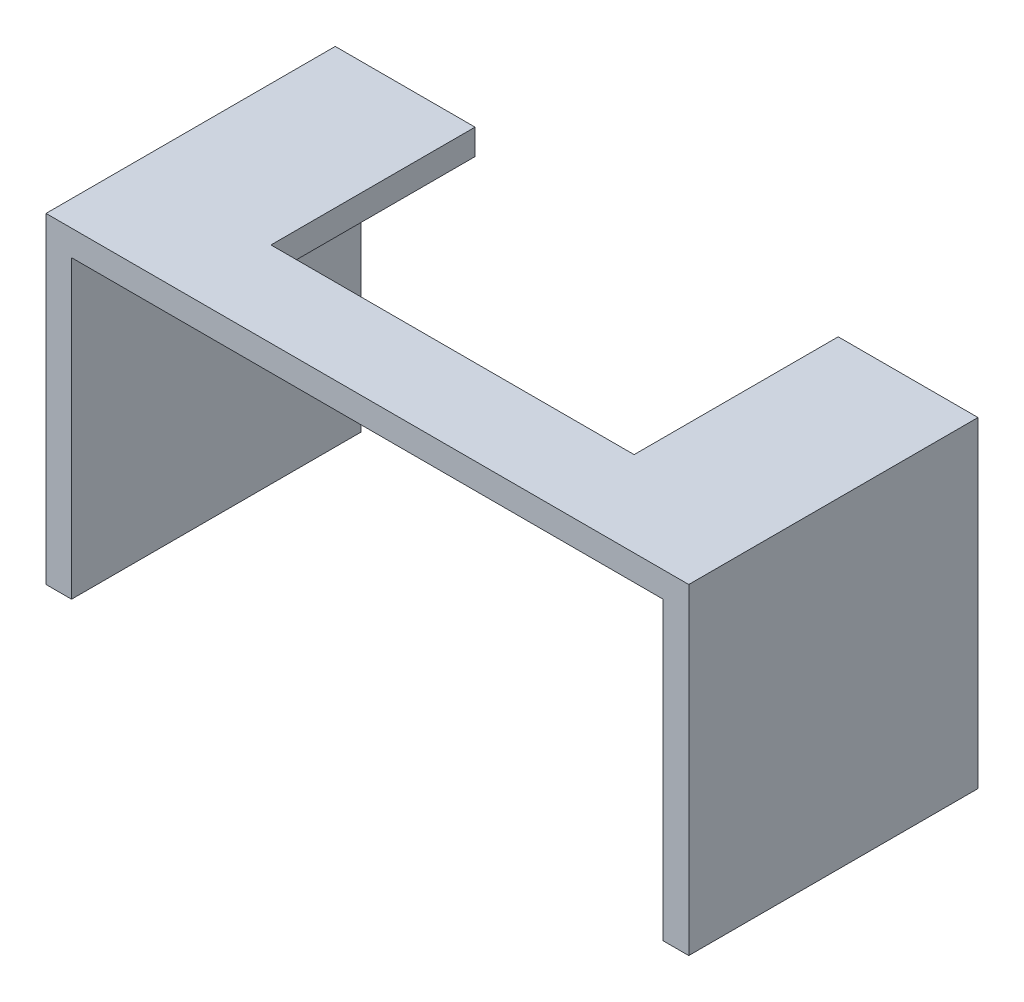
SolidWorks part; units mm, degrees
ref_plane "Front Plane" through (0, 0, 0) normal (0, 0, 1) x (1, 0, 0)
ref_plane "Top Plane" through (0, 0, 0) normal (0, 1, 0) x (1, 0, 0)
ref_plane "Right Plane" through (0, 0, 0) normal (1, 0, 0) x (0, 0, -1)
sketch "Sketch1" plane through (0, 0, 0) normal (0, 0, 1) x (1, 0, 0)
  line L0 (1.59, -20) -> (1.59, -1.59)
  line L1 (0, -20) -> (0, 0)
  line L2 (0, 0) -> (40, 0)
  line L3 (40, 0) -> (40, -20)
  line L4 (1.59, -1.59) -> (38.41, -1.59)
  line L5 (38.41, -1.59) -> (38.41, -20)
  line L6 (0, -20) -> (1.59, -20)
  line L7 (38.41, -20) -> (40, -20)
  dimension "D1" = 40
  dimension "D2" = 1.59
  dimension "D3" = 20
extrude "Boss-Extrude1" add sketch "Sketch1" along normal blind 18
sketch "Sketch2" plane through (0, 0, 0) normal (0, 1, 0) x (1, 0, 0)
  line L0 (8.7, 0) -> (8.7, -12.7)
  line L1 (40, 0) -> (0, 0) construction
  line L2 (8.7, -12.7) -> (31.3, -12.7)
  line L3 (31.3, -12.7) -> (31.3, 0)
  line L5 (20, 0) -> (20, -12.7) construction
  line L6 (8.7, 0) -> (31.3, 0)
  dimension "D1" = 22.6
  dimension "D2" = 12.7
extrude "Cut-Extrude1" cut sketch "Sketch2" against normal blind 10
